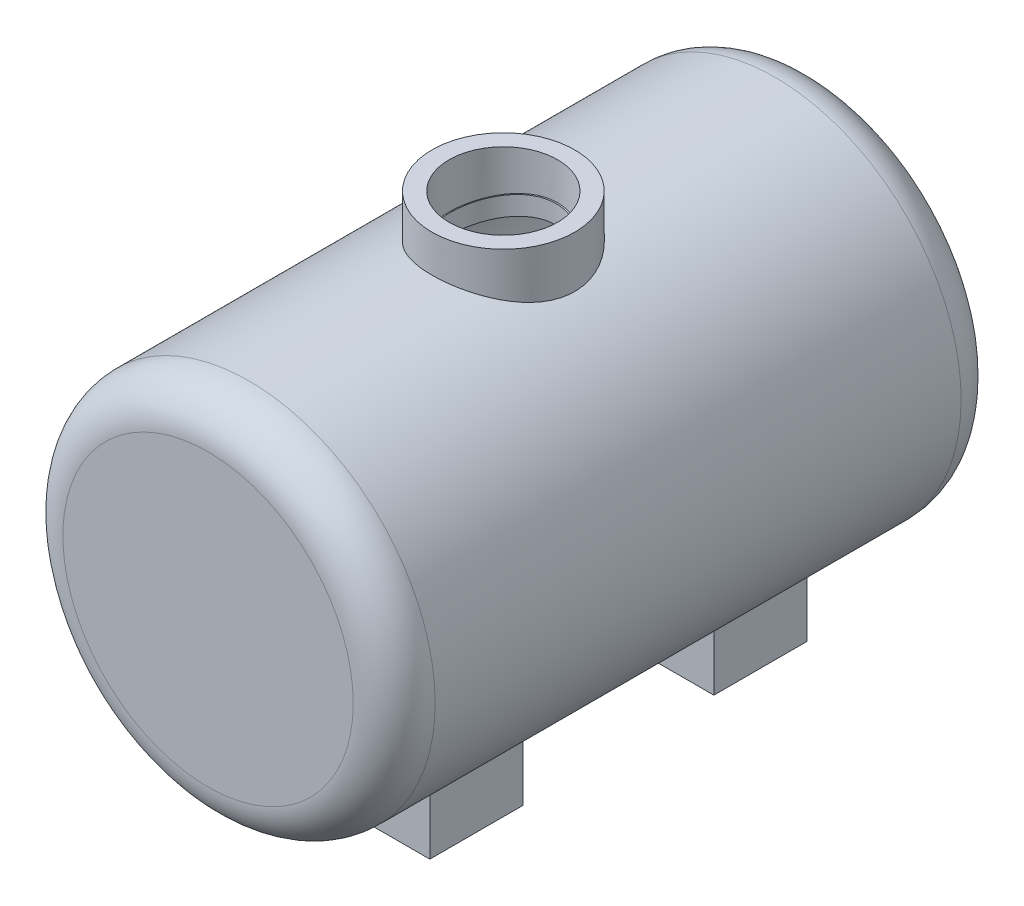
SolidWorks part; units mm, degrees
ref_plane "Alzado" through (0, 0, 0) normal (0, 0, 1) x (1, 0, 0)
ref_plane "Planta" through (0, 0, 0) normal (0, 1, 0) x (1, 0, 0)
ref_plane "Vista lateral" through (0, 0, 0) normal (1, 0, 0) x (0, 0, -1)
sketch "Croquis1" plane through (0, 0, 0) normal (0, 0, 1) x (1, 0, 0)
  circle A0 centre (0, 0) radius 500
  dimension "D1" = 1000
extrude "Saliente-Extruir1" add sketch "Croquis1" along normal blind 1633
fillet "Redondeo1" radius 110 2 edges at (500, 0, 0) (500, 0, 1633)
ref_plane "Plano1" through (0, 600, 0) normal (0, 1, 0) x (-1, 0, 0)
sketch "Croquis2" plane through (0, 600, 0) normal (0, 1, 0) x (-1, 0, 0)
  circle A0 centre (0, 839.7501) radius 191.6803
  circle A1 centre (0, 839.7501) radius 145.6885
extrude "Saliente-Extruir2" add sketch "Croquis2" against normal up to surface (100 mm away)
shell "Vaciado1" thickness 50
ref_plane "Plano2" through (0, -570, 0) normal (0, 1, 0) x (-1, 0, 0)
sketch "Croquis3" plane through (0, -570, 0) normal (0, 1, 0) x (-1, 0, 0)
  line L0 (-500, 1523) -> (500, 1523) construction
  line L1 (-285.6915, 1323) -> (361.8759, 1323)
  line L2 (-285.6915, 1323) -> (-285.6915, 1073)
  line L3 (-285.6915, 1073) -> (361.8759, 1073)
  line L4 (361.8759, 1323) -> (361.8759, 1073)
  line L5 (-285.6915, 560) -> (361.8759, 560)
  line L6 (-285.6915, 560) -> (-285.6915, 310)
  line L7 (-285.6915, 310) -> (361.8759, 310)
  line L8 (361.8759, 560) -> (361.8759, 310)
  line L9 (-500, 110) -> (500, 110) construction
  dimension "D1" = 250
  dimension "D2" = 200
  dimension "D3" = 200
  dimension "D4" = 250
extrude "Saliente-Extruir3" add sketch "Croquis3" along normal up to surface (224.9698 mm away)
